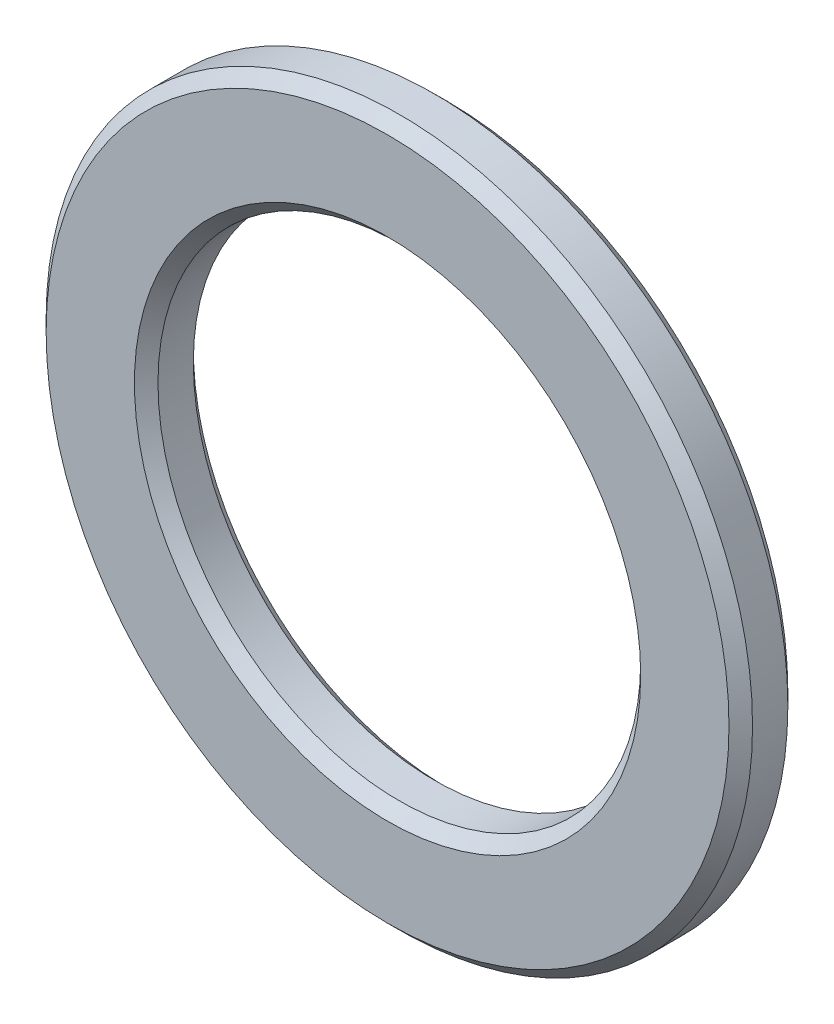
SolidWorks part; units mm, degrees
ref_plane "Front Plane" through (0, 0, 0) normal (0, 0, 1) x (1, 0, 0)
ref_plane "Top Plane" through (0, 0, 0) normal (0, 1, 0) x (1, 0, 0)
ref_plane "Right Plane" through (0, 0, 0) normal (1, 0, 0) x (0, 0, -1)
sketch "Sketch1" plane through (0, 0, 0) normal (0, 0, 1) x (1, 0, 0)
  circle A0 centre (0, 0) radius 6
  circle A1 centre (0, 0) radius 4.1
  dimension "D1" = 12
  dimension "D2" = 8.2
extrude "Boss-Extrude2" add sketch "Sketch1" along normal mid plane 1
chamfer "Chamfer3" distance 0.2 angle 45 4 edges at (6, 0, 0.5) (6, 0, -0.5) (4.1, 0, -0.5) (4.1, 0, 0.5)
